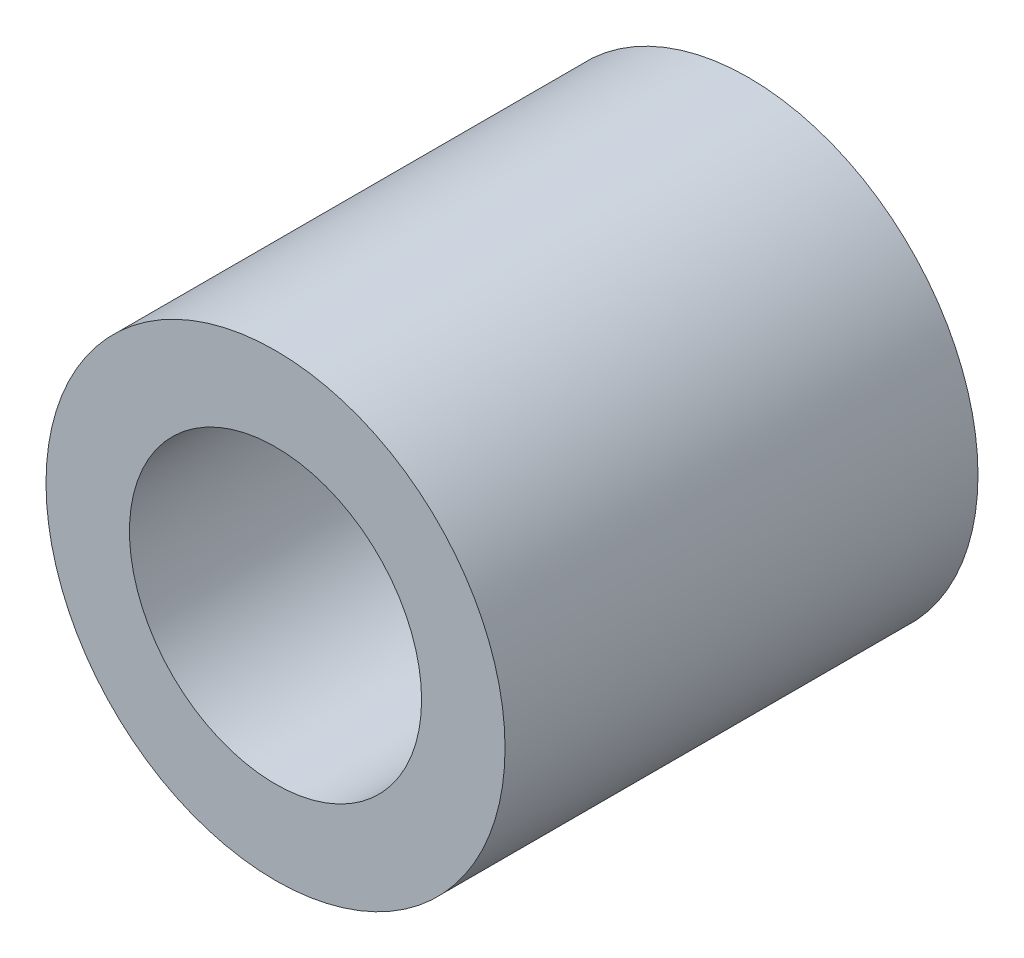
SolidWorks part; units mm, degrees
ref_plane "Plan de face" through (0, 0, 0) normal (0, 0, 1) x (1, 0, 0)
ref_plane "Plan de dessus" through (0, 0, 0) normal (0, 1, 0) x (1, 0, 0)
ref_plane "Plan de droite" through (0, 0, 0) normal (1, 0, 0) x (0, 0, -1)
sketch "Esquisse1" plane through (0, 0, 0) normal (0, 0, 1) x (1, 0, 0)
  circle A0 centre (0, 0) radius 5.25
  circle A1 centre (0, 0) radius 8.25
  dimension "D1" = 16.5
  dimension "D2" = 10.5
extrude "Extrusion1" add sketch "Esquisse1" along normal blind 17
